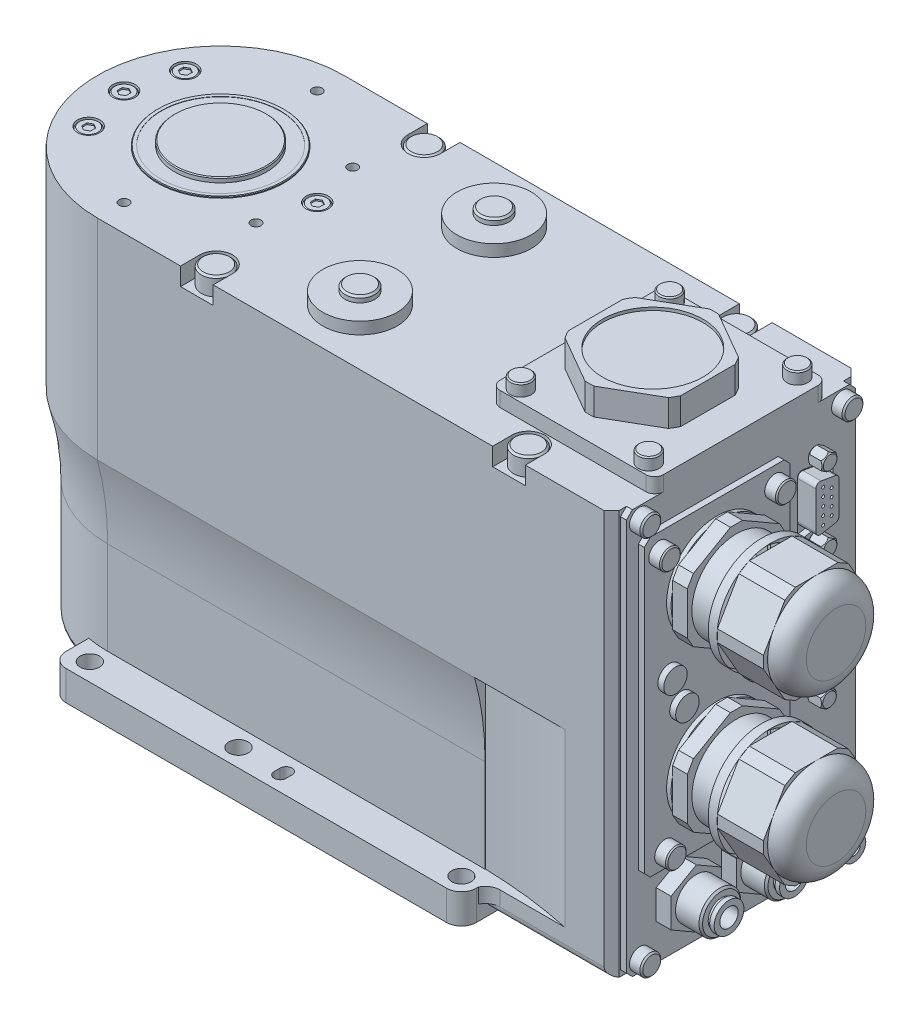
SolidWorks part; units mm, degrees
ref_plane "Front Plane" through (0, 0, 0) normal (0, 0, 1) x (1, 0, 0)
ref_plane "Top Plane" through (0, 0, 0) normal (0, 1, 0) x (1, 0, 0)
ref_plane "Right Plane" through (0, 0, 0) normal (1, 0, 0) x (0, 0, -1)
imported_body "Imported1"
sketch "Sketch1" plane through (0, 150, 0) normal (0, 1, 0) x (1, 0, 0)
  circle A2 centre (145.34, 0) radius 16.9
  dimension "D1" = 33.8
  dimension "D2" = 145.34
extrude "Cut-Extrude1" cut sketch "Sketch1" against normal blind 1
